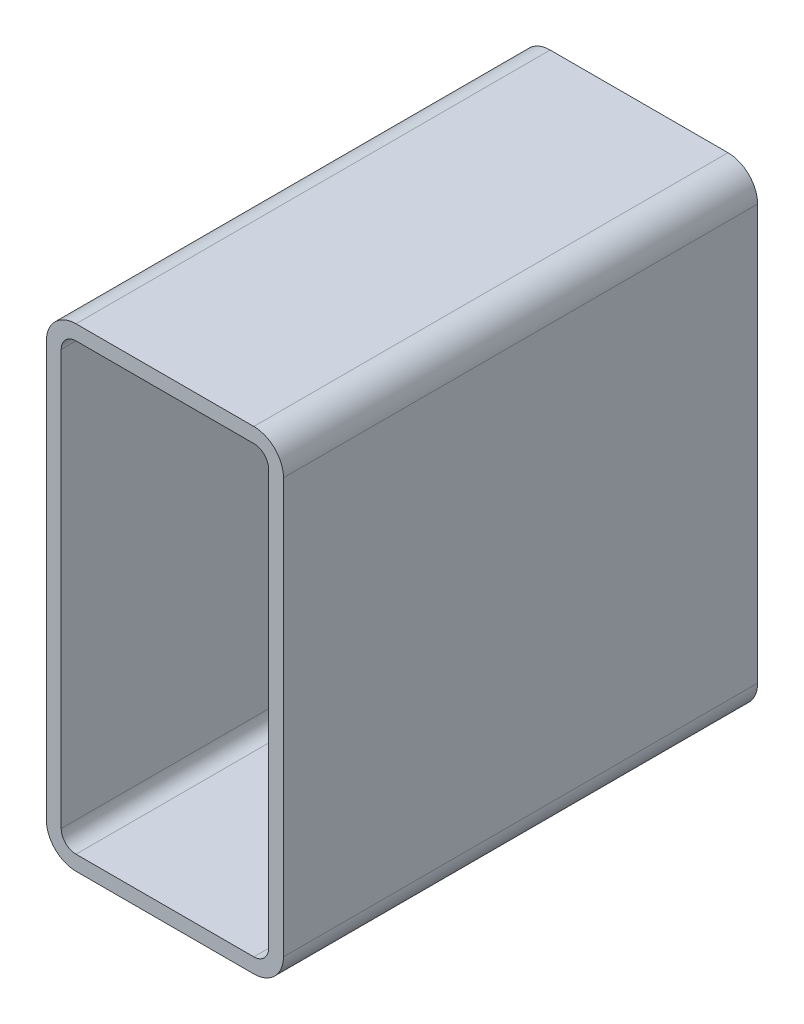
SolidWorks part; units mm, degrees
ref_plane "Front Plane" through (0, 0, 0) normal (0, 0, 1) x (1, 0, 0)
ref_plane "Top Plane" through (0, 0, 0) normal (0, 1, 0) x (1, 0, 0)
ref_plane "Right Plane" through (0, 0, 0) normal (1, 0, 0) x (0, 0, -1)
sketch "Sketch1" plane through (0, 0, 0) normal (0, 0, 1) x (1, 0, 0)
sketch_block_instance "HSS12x6x0.375-1"
sketch_block "HSS12x6x0.375"
extrude "Boss-Extrude1" add sketch "Sketch1" along normal blind 304.8
